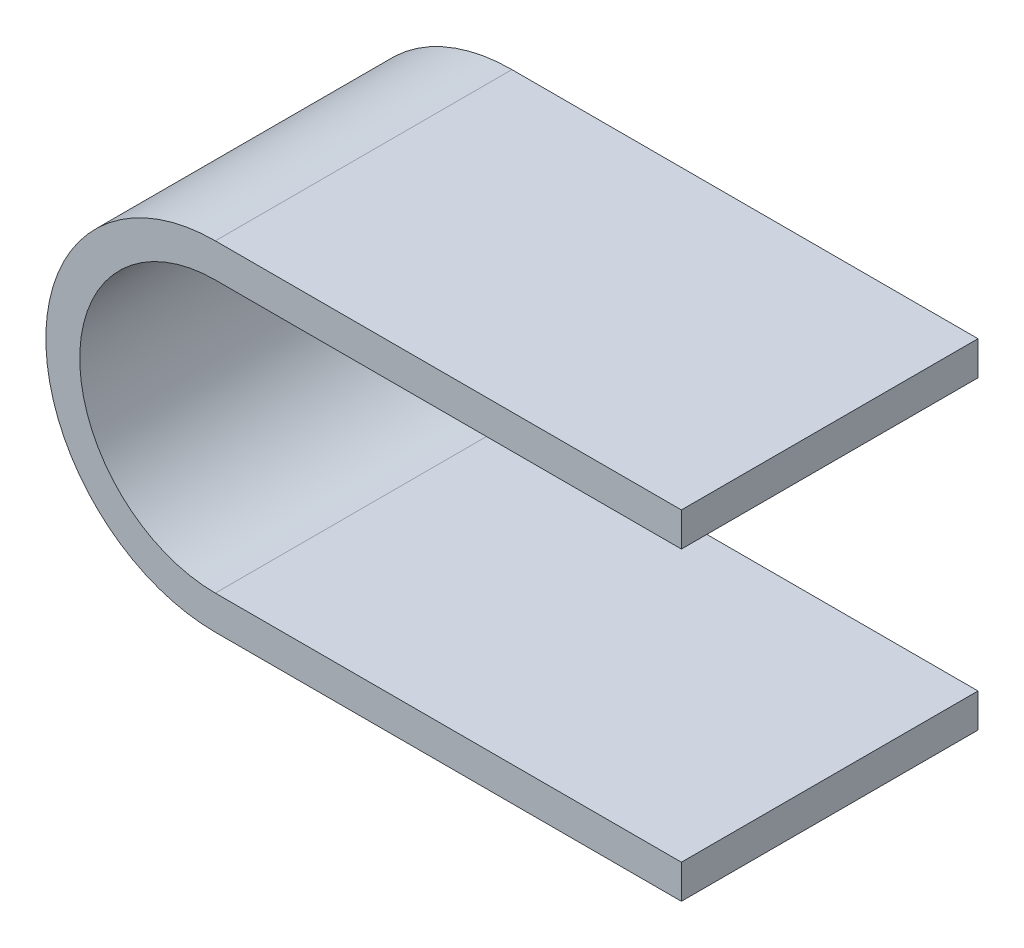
SolidWorks part; units mm, degrees
ref_plane "Plan de face" through (0, 0, 0) normal (0, 0, 1) x (1, 0, 0)
ref_plane "Plan de dessus" through (0, 0, 0) normal (0, 1, 0) x (1, 0, 0)
ref_plane "Plan de droite" through (0, 0, 0) normal (1, 0, 0) x (0, 0, -1)
sketch "Esquisse1" plane through (0, 0, 0) normal (0, 0, 1) x (1, 0, 0)
  line L0 (0, 0) -> (-55, 0)
  line L1 (0, 32) -> (-55, 32)
  line L2 (0, -4) -> (-55, -4)
  line L3 (0, 36) -> (-55, 36)
  line L4 (0, 36) -> (0, 32)
  line L5 (0, 0) -> (0, -4)
  arc A0 (-55, 0) -> (-55, 32) centre (-55, 16) cw
  arc A1 (-55, -4) -> (-55, 36) centre (-55, 16) cw
  dimension "D1" = 16
  dimension "D2" = 55
  dimension "D3" = 55
  dimension "D4" = 4
extrude "Boss.-Extru.1" add sketch "Esquisse1" along normal blind 35
